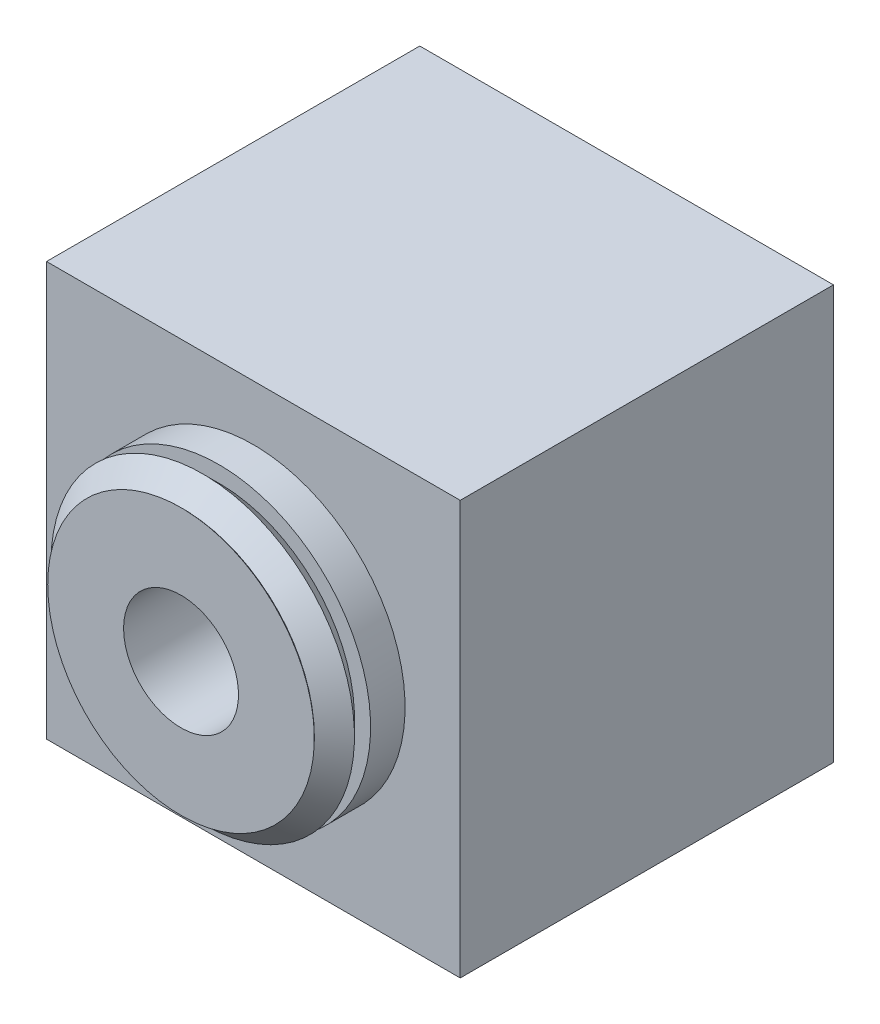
SolidWorks part; units mm, degrees
ref_plane "Front" through (0, 0, 0) normal (0, 0, 1) x (1, 0, 0)
ref_plane "Top" through (0, 0, 0) normal (0, 1, 0) x (1, 0, 0)
ref_plane "Right" through (0, 0, 0) normal (1, 0, 0) x (0, 0, -1)
ref_plane "Body Plane" through (0, 0, -3.9982) normal (0, 0, 1) x (1, 0, 0)
sketch "Sketch1" plane through (0, 0, 0) normal (1, 0, 0) x (0, 0, -1)
  line L0 (71.2941, 0) -> (-67.6458, 0) construction
  line L1 (0, 0) -> (0, 7.366)
  line L2 (0, 7.366) -> (0.0927, 7.2733)
  line L3 (0.0927, 7.2733) -> (1.2014, 8.382)
  line L4 (1.2014, 8.382) -> (2.0932, 7.4902)
  line L5 (2.0932, 7.4902) -> (2.0932, 8.382)
  line L6 (2.0932, 8.382) -> (3.9982, 8.382)
  line L7 (3.9982, 8.382) -> (3.9982, 0)
  line L8 (3.9982, 0) -> (0, 0)
  dimension "D1" = 45
  dimension "D2" = 8.382
  dimension "D3" = 8.382
  dimension "D4" = 0.8918
  dimension "D5" = 1.2014
  dimension "D6" = 7.366
  dimension "Front Length" = 1.905
revolve "Base" add sketch "Sketch1" angle 360 about L0
sketch "Sketch9" plane through (0, 0, -3.9982) normal (0, 0, -1) x (-1, 0, 0)
  line L1 (-11.43, 11.43) -> (11.43, 11.43)
  line L2 (-11.43, 11.43) -> (-11.43, -11.43)
  line L3 (-11.43, -11.43) -> (11.43, -11.43)
  line L4 (11.43, 11.43) -> (11.43, -11.43)
  point P4 (0, 11.43)
  point P5 (11.43, 0)
  dimension "D1" = 22.86
  dimension "D2" = 22.86
extrude "F Body" add sketch "Sketch9" along normal blind 20.6248
sketch "Sketch11" plane through (0, 0, -24.623) normal (0, 0, -1) x (-1, 0, 0)
  line L0 (-11.43, 11.43) -> (11.43, -11.43) construction
  circle A0 centre (6.9182, 6.5522) radius 1.7272
  circle A1 centre (-6.5522, -6.9182) radius 1.7272
  dimension "D1" = 3.4544
  dimension "D2" = 19.05
extrude "F Mounting Holes" cut sketch "Sketch11" against normal blind 7.9248
sketch "Sketch14" plane through (-11.43, 0, 0) normal (-1, 0, 0) x (0, 0, 1)
  line L0 (-24.623, -11.43) -> (-24.623, 11.43) construction
  circle A0 centre (-7.1732, 5.5499) radius 1.7272
  circle A1 centre (-18.273, -5.5499) radius 1.7272
  dimension "D1" = 3.4544
  dimension "D2" = 3.4544
  dimension "D3" = 6.35
  dimension "D4" = 11.0998
  dimension "D5" = 5.5499
  dimension "D6" = 5.5499
extrude "FSR Mounting Holes" cut sketch "Sketch14" against normal blind 4.7498
sketch "Sketch10" plane through (0, 0, -24.623) normal (0, 0, -1) x (-1, 0, 0)
  circle A0 centre (0, 0) radius 6.35
  dimension "D1" = 12.7
extrude "F Body 2" add sketch "Sketch10" along normal blind 1.5748
sketch "Sketch3" plane through (0, 0, 0) normal (0, 0, -1) x (-1, 0, 0)
  circle A0 centre (0, 0) radius 3.175
  dimension "D1" = 6.35
extrude "Hole Cut" cut sketch "Sketch3" along normal through all
